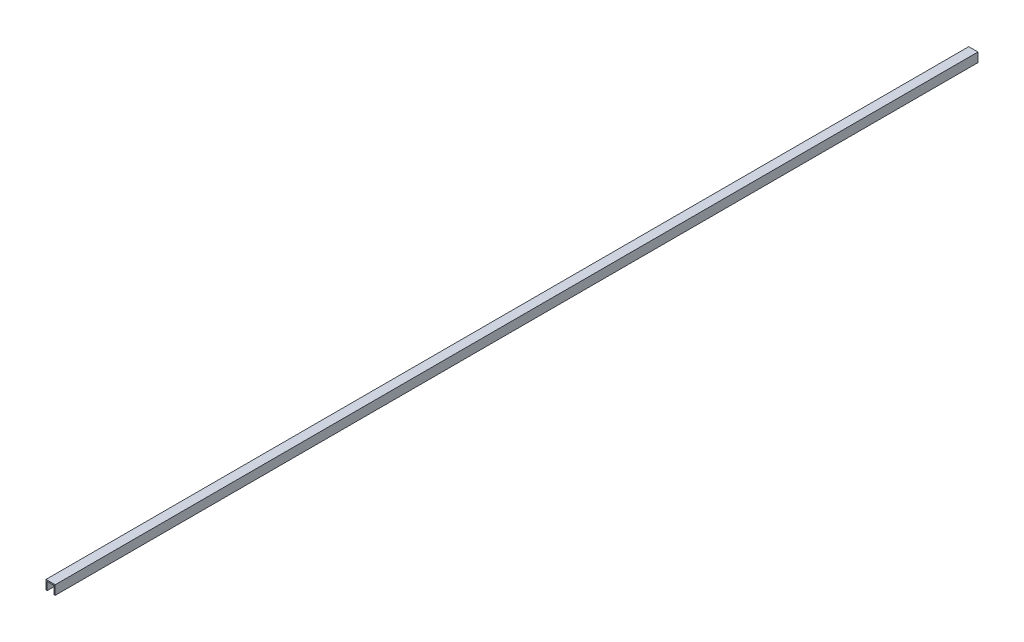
SolidWorks part; units mm, degrees
ref_plane "Ebene vorne" through (0, 0, 0) normal (0, 0, 1) x (1, 0, 0)
ref_plane "Ebene oben" through (0, 0, 0) normal (0, 1, 0) x (1, 0, 0)
ref_plane "Ebene rechts" through (0, 0, 0) normal (1, 0, 0) x (0, 0, -1)
sketch "Skizze1" plane through (0, 0, 0) normal (0, 0, 1) x (1, 0, 0)
  line L1 (4, -4) -> (-4, -4)
  line L2 (4, -4) -> (4, 4)
  line L3 (4, 4) -> (-4, 4)
  line L4 (-4, -4) -> (-4, 4)
  line L5 (4, -4) -> (-4, 4) construction
  line L6 (4, 4) -> (-4, -4) construction
  point P0 (0, 0)
  dimension "D1" = 8
extrude "Aufsatz-Linear austragen1" add sketch "Skizze1" along normal mid plane 800 contours L3 L4 L1 L2
shell "Wandung1" thickness 1
